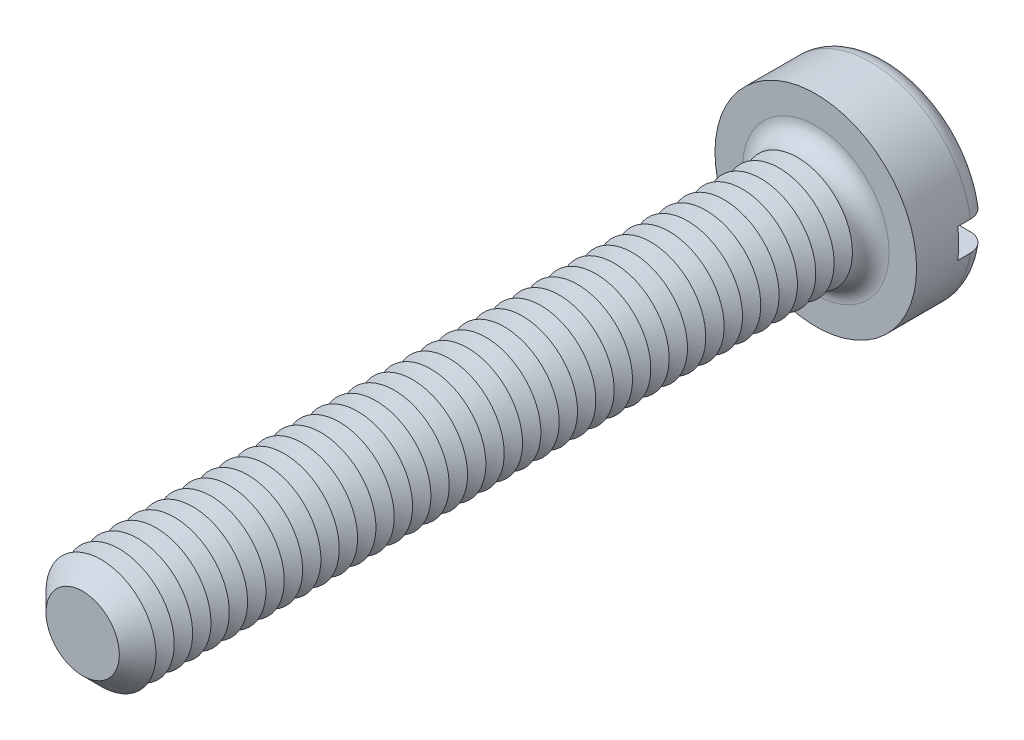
SolidWorks part; units mm, degrees
ref_plane "Front Plane" through (0, 0, 0) normal (0, 0, 1) x (1, 0, 0)
ref_plane "Top Plane" through (0, 0, 0) normal (0, 1, 0) x (1, 0, 0)
ref_plane "Right Plane" through (0, 0, 0) normal (1, 0, 0) x (0, 0, -1)
sketch "Sketch3" plane through (0, 0, 0) normal (0, 0, 1) x (1, 0, 0)
  circle A0 centre (0, 0) radius 2.75
  dimension "D1" = 5.5
extrude "Boss-Extrude2" add sketch "Sketch3" against normal blind 2
sketch "Sketch4" plane through (0, 0, 0) normal (0, 0, 1) x (1, 0, 0)
  circle A0 centre (0, 0) radius 1.5
  dimension "D1" = 3
extrude "Boss-Extrude3" add sketch "Sketch4" along normal blind 20
fillet "Fillet1" radius 0.5 2 edges at (2.75, 0, -2) (1.5, 0, 0)
chamfer "Chamfer1" distance 0.5 angle 45 1 edges at (1.5, 0, 20)
sketch "Sketch5" plane through (0, 0, 0) normal (1, 0, 0) x (0, 0, -1)
  line L0 (1.6944, 0) -> (-7.6738, 0) construction
sketch "Sketch6" plane through (0, 0, 0) normal (1, 0, 0) x (0, 0, -1)
  line L0 (-0.5, 1.5) -> (-0.75, 1.067)
  line L1 (-0.75, 1.067) -> (-1, 1.5)
  line L2 (-0.5, 1.5) -> (-19.5, 1.5) construction
  line L3 (-1, 1.5) -> (-0.5, 1.5)
  dimension "D1" = 0.5
revolve "Cut-Revolve1" cut sketch "Sketch6" angle 360 about L0
pattern_linear "LPattern1" count 38 spacing 0.5 along (0, 0, 1) of "Cut-Revolve1"
sketch "Sketch8" plane through (0, 0, -2) normal (0, 0, -1) x (-1, 0, 0)
  line L1 (2.75, -0.4) -> (-2.75, -0.4)
  line L2 (2.75, -0.4) -> (2.75, 0.4)
  line L3 (2.75, 0.4) -> (-2.75, 0.4)
  line L4 (-2.75, -0.4) -> (-2.75, 0.4)
  line L5 (2.75, -0.4) -> (-2.75, 0.4) construction
  line L6 (2.75, 0.4) -> (-2.75, -0.4) construction
  point P0 (0, 0)
  dimension "D1" = 5.5
  dimension "D2" = 0.8
extrude "Cut-Extrude1" cut sketch "Sketch8" against normal blind 0.85
